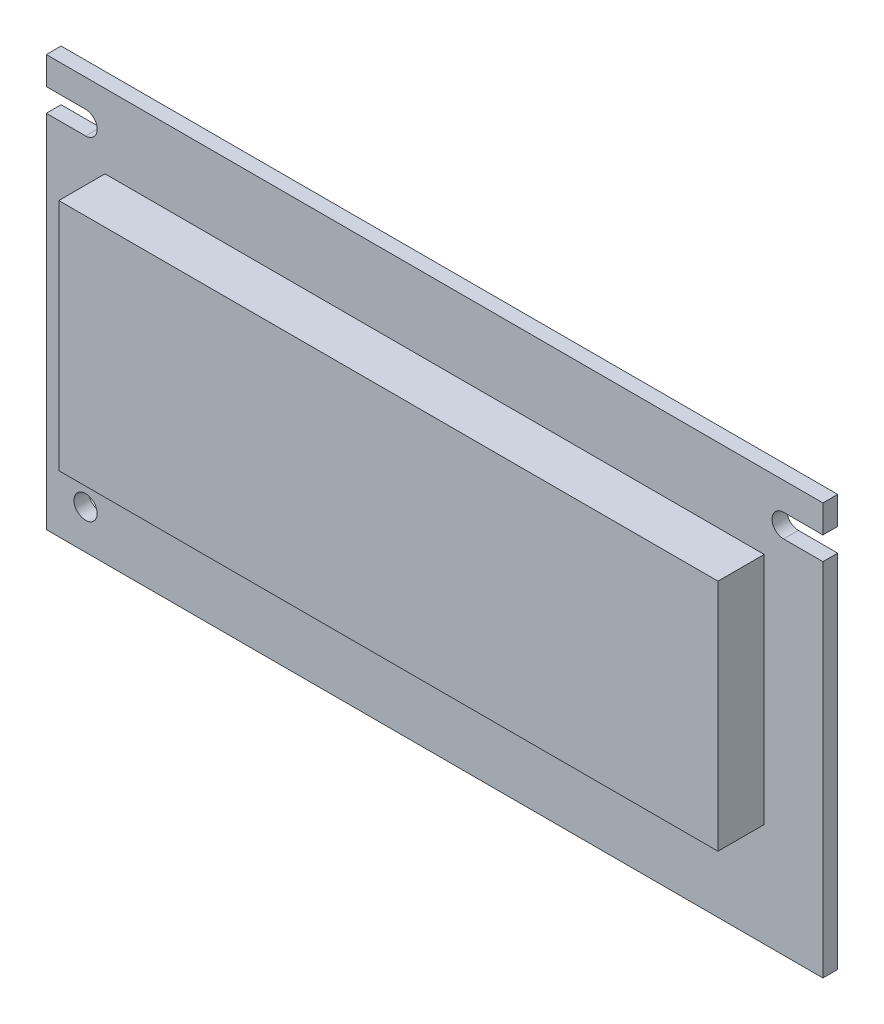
SolidWorks part; units mm, degrees
ref_plane "Plan de face" through (0, 0, 0) normal (0, 0, 1) x (1, 0, 0)
ref_plane "Plan de dessus" through (0, 0, 0) normal (0, 1, 0) x (1, 0, 0)
ref_plane "Plan de droite" through (0, 0, 0) normal (1, 0, 0) x (0, 0, -1)
sketch "Esquisse1" plane through (0, 0, 0) normal (0, 0, 1) x (1, 0, 0)
  line L1 (0, 0) -> (84, 0)
  line L2 (0, 0) -> (0, 44.5)
  line L3 (0, 44.5) -> (84, 44.5)
  line L4 (84, 0) -> (84, 44.5)
  dimension "D1" = 84
  dimension "D2" = 44.5
extrude "Boss.-Extru.1" add sketch "Esquisse1" along normal blind 1.6
sketch "Esquisse2" plane through (0, 0, 1.6) normal (0, 0, 1) x (1, 0, 0)
  line L0 (0, 44.5) -> (0, 0) construction
  line L1 (6.35, 36.5) -> (77.65, 36.5)
  line L2 (6.35, 36.5) -> (6.35, 11.2)
  line L3 (6.35, 11.2) -> (77.65, 11.2)
  line L4 (77.65, 36.5) -> (77.65, 11.2)
  line L5 (84, 44.5) -> (0, 44.5) construction
  dimension "D1" = 25.3
  dimension "D2" = 71.3
  dimension "D3" = 6.35
  dimension "D4" = 8
extrude "Boss.-Extru.2" add sketch "Esquisse2" along normal blind 5
sketch "Esquisse3" plane through (0, 0, 1.6) normal (0, 0, 1) x (1, 0, 0)
  line L0 (84, 44.5) -> (0, 44.5) construction
  line L1 (0, 44.5) -> (0, 0) construction
  circle A0 centre (79.75, 40.25) radius 1.25
  circle A2 centre (4.25, 4.25) radius 1.25
  circle A3 centre (4.25, 40.25) radius 1.25
  dimension "D1" = 2.5
  dimension "D4" = 2.5
  dimension "D5" = 4.25
  dimension "D3" = 75.5
  dimension "D7" = 4.25
  dimension "D8" = 2.5
  dimension "D9" = 36
extrude "Enlèv. mat.-Extru.1" cut sketch "Esquisse3" against normal up to next
sketch "Esquisse4" plane through (0, 0, 0) normal (0, 0, -1) x (-1, 0, 0)
  line L0 (0, 44.5) -> (0, 0) construction
  line L1 (-67, 20) -> (-8, 20)
  line L2 (-67, 20) -> (-67, 0)
  line L3 (-67, 0) -> (-8, 0)
  line L4 (-8, 20) -> (-8, 0)
  line L6 (0, 0) -> (-84, 0) construction
  dimension "D1" = 20
  dimension "D2" = 59
  dimension "D3" = 8
extrude "Boss.-Extru.3" add sketch "Esquisse4" along normal blind 12.5
sketch "Esquisse5" plane through (8, 0, 0) normal (-1, 0, 0) x (0, 0, 1)
  line L0 (-12.5, 0) -> (-12.5, 20) construction
  line L1 (-7.5, 15.5368) -> (-5.5, 15.5368)
  line L2 (-7.5, 15.5368) -> (-7.5, 7.5368)
  line L3 (-7.5, 7.5368) -> (-5.5, 7.5368)
  line L4 (-5.5, 15.5368) -> (-5.5, 7.5368)
  dimension "D1" = 2
  dimension "D2" = 8
  dimension "D3" = 5
extrude "Boss.-Extru.4" add sketch "Esquisse5" along normal blind 6
sketch "Esquisse6" plane through (0, 0, 1.6) normal (0, 0, 1) x (1, 0, 0)
  line L0 (84, 0) -> (84, 44.5) construction
  line L1 (79.75, 41.5) -> (84, 41.5)
  line L2 (0, 44.5) -> (0, 0) construction
  line L3 (79.75, 39) -> (84, 39)
  line L4 (84, 41.5) -> (84, 39)
  line L6 (4.25, 41.5) -> (0, 41.5)
  line L8 (4.25, 39) -> (0, 39)
  line L9 (0, 41.5) -> (0, 39)
  circle A0 centre (79.75, 40.25) radius 1.25 construction
  circle A1 centre (4.25, 40.25) radius 1.25 construction
  arc A2 (79.75, 41.5) -> (79.75, 39) centre (79.75, 40.25) ccw
  arc A3 (4.25, 39) -> (4.25, 41.5) centre (4.25, 40.25) ccw
extrude "Enlèv. mat.-Extru.2" cut sketch "Esquisse6" against normal up to next
